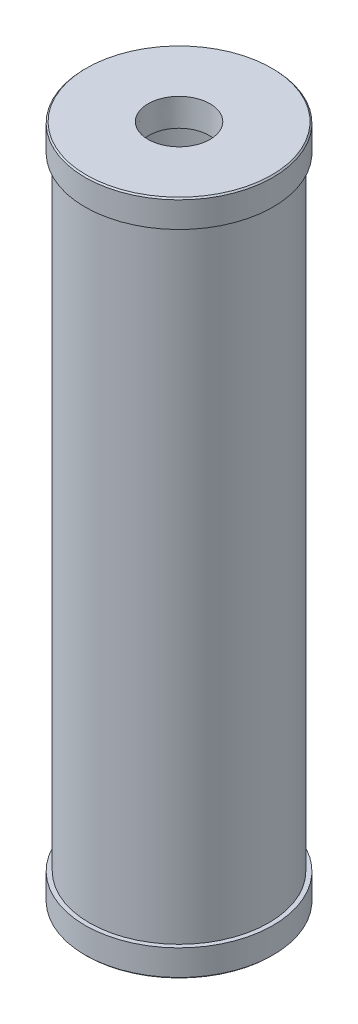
SolidWorks part; units mm, degrees
ref_plane "Front Plane" through (0, 0, 0) normal (0, 0, 1) x (1, 0, 0)
ref_plane "Top Plane" through (0, 0, 0) normal (0, 1, 0) x (1, 0, 0)
ref_plane "Right Plane" through (0, 0, 0) normal (1, 0, 0) x (0, 0, -1)
sketch "Sketch1" plane through (0, 0, 0) normal (0, 1, 0) x (1, 0, 0)
  circle A0 centre (0, 0) radius 84.201
  circle A1 centre (0, 0) radius 74.676
  dimension "D1" = 168.402
  dimension "D2" = 9.525
extrude "Boss-Extrude1" add sketch "Sketch1" along normal blind 635
ref_plane "Plane1" through (0, 635, 0) normal (0, 1, 0) x (1, 0, 0)
sketch "Sketch2" plane through (0, 0, 0) normal (0, 1, 0) x (1, 0, 0)
  circle A0 centre (0, 0) radius 88.265
  dimension "D1" = 176.53
extrude "Boss-Extrude2" add sketch "Sketch2" along normal blind 25.4
sketch "Sketch3" plane through (0, 635, 0) normal (0, 1, 0) x (1, 0, 0)
  circle A0 centre (0, 0) radius 88.265
  dimension "D1" = 176.53
extrude "Boss-Extrude3" add sketch "Sketch3" against normal blind 25.4
hole_wizard "2 Rc Tapped Hole1" positions "Sketch5" profile "Sketch4" size "2" standard "BSI"
sketch "Sketch5" plane through (0, 635, 0) normal (0, 1, 0) x (1, 0, 0)
  point P0 (0, 0)
sketch "Sketch4" plane through (0, 635, 0) normal (1, 0, 0) x (0, 0, 1)
  line L0 (0, 0) -> (0, 53.5476)
  line L1 (27.4, 37.084) -> (0, 53.5476)
  line L2 (-27.4, 37.084) -> (0, 53.5476) construction
  line L3 (27.4, 37.084) -> (27.4, 25.654)
  line L4 (27.4, 25.654) -> (28.2652, 25.654)
  line L5 (28.2652, 25.654) -> (29.0661, 0)
  line L6 (-28.2652, 25.654) -> (-29.0661, 0) construction
  line L7 (29.0661, 0) -> (0, 0)
  line L8 (0, -6.35) -> (0, 107.95) construction
  line L11 (-27.4, 25.654) -> (-28.2652, 25.654) construction
  dimension "Tap Drill Dia." = 54.8
  dimension "Tap Drill Depth" = 37.084
  dimension "Thread Dia." = 58.1321
  dimension "Thread Angle" = 3.576
  dimension "Thread Depth" = 25.654
  dimension "Drill Angle" = 118
hole_wizard "2 Rc Tapped Hole2" positions "Sketch11" profile "Sketch10" size "2" standard "BSI"
sketch "Sketch11" plane through (0, 0, 0) normal (0, 1, 0) x (1, 0, 0)
  point P0 (0, 0)
sketch "Sketch10" plane through (0, 0, 0) normal (1, 0, 0) x (0, 0, -1)
  line L0 (0, 0) -> (0, 53.5476)
  line L1 (27.4, 37.084) -> (0, 53.5476)
  line L2 (-27.4, 37.084) -> (0, 53.5476) construction
  line L3 (27.4, 37.084) -> (27.4, 25.654)
  line L4 (27.4, 25.654) -> (28.2652, 25.654)
  line L5 (28.2652, 25.654) -> (29.0661, 0)
  line L6 (-28.2652, 25.654) -> (-29.0661, 0) construction
  line L7 (29.0661, 0) -> (0, 0)
  line L8 (0, -6.35) -> (0, 107.95) construction
  line L11 (-27.4, 25.654) -> (-28.2652, 25.654) construction
  dimension "Tap Drill Dia." = 54.8
  dimension "Tap Drill Depth" = 37.084
  dimension "Thread Dia." = 58.1321
  dimension "Thread Angle" = 3.576
  dimension "Thread Depth" = 25.654
  dimension "Drill Angle" = 118
chamfer "Chamfer1" distance 1.27 angle 45 2 edges at (0, 0, 88.265) (0, 635, 88.265)
